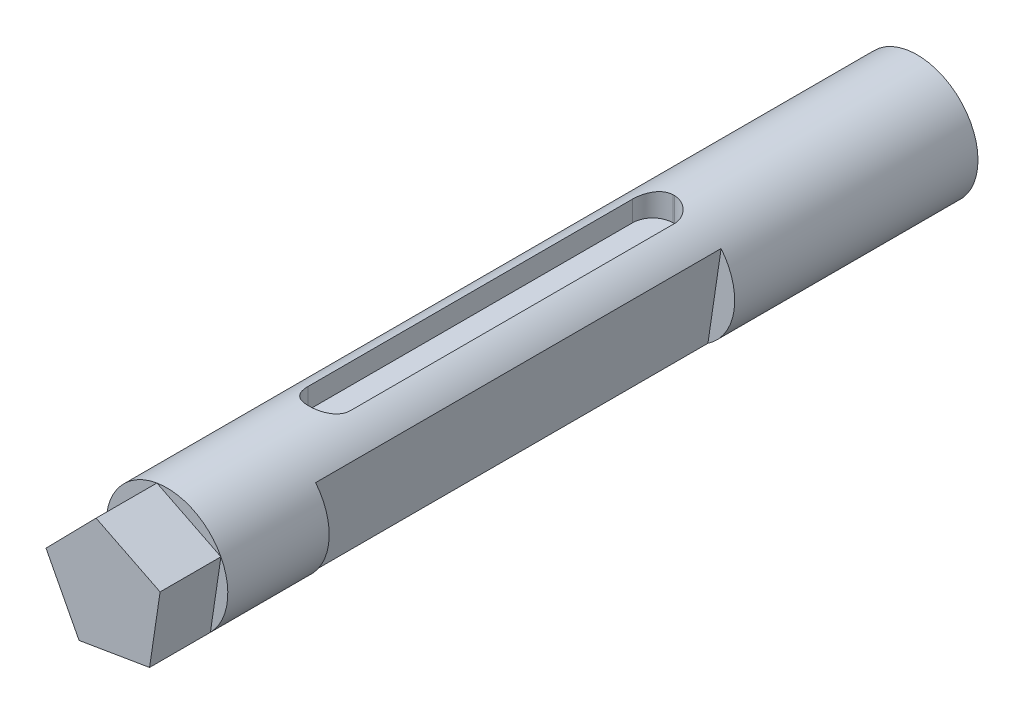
SolidWorks part; units mm, degrees
ref_plane "Front Plane" through (0, 0, 0) normal (0, 0, 1) x (1, 0, 0)
ref_plane "Top Plane" through (0, 0, 0) normal (0, 1, 0) x (1, 0, 0)
ref_plane "Right Plane" through (0, 0, 0) normal (1, 0, 0) x (0, 0, -1)
sketch "Sketch2" plane through (0, 0, 0) normal (0, 0, 1) x (1, 0, 0)
  circle A0 centre (0, 0) radius 19.05
  dimension "D1" = 38.1
extrude "Boss-Extrude1" add sketch "Sketch2" along normal blind 254
sketch "Sketch3" plane through (0, 0, 254) normal (0, 0, 1) x (1, 0, 0)
  line L1 (13.5955, -13.3441) -> (16.8922, 8.8066)
  line L2 (16.8922, 8.8066) -> (-3.1556, 18.7868)
  line L3 (-3.1556, 18.7868) -> (-18.8425, 2.8043)
  line L4 (-18.8425, 2.8043) -> (-8.4897, -17.0537)
  line L5 (-8.4897, -17.0537) -> (13.5955, -13.3441)
  line L6 (-32.0734, 26.7428) -> (32.0734, 26.7428)
  line L7 (-32.0734, 26.7428) -> (-32.0734, -26.7428)
  line L8 (-32.0734, -26.7428) -> (32.0734, -26.7428)
  line L9 (32.0734, 26.7428) -> (32.0734, -26.7428)
  line L10 (-32.0734, 26.7428) -> (32.0734, -26.7428) construction
  line L11 (-32.0734, -26.7428) -> (32.0734, 26.7428) construction
  circle A0 centre (0, 0) radius 15.4118 construction
extrude "Cut-Extrude2" cut sketch "Sketch3" against normal blind 19.05
ref_plane "Plane1" through (0, 19.05, 0) normal (0, 1, 0) x (1, 0, 0)
sketch "Sketch4" plane through (0, 19.05, 0) normal (0, 1, 0) x (1, 0, 0)
  line L0 (16.8922, -254) -> (-3.1556, -254) construction
  line L1 (0.2488, -76.2) -> (-0.2592, -76.2)
  line L2 (6.5988, -82.55) -> (6.5988, -184.15)
  line L3 (0.2488, -190.5) -> (-0.2592, -190.5)
  line L4 (-6.6092, -82.55) -> (-6.6092, -184.15)
  line L5 (6.5988, -76.2) -> (-6.6092, -190.5) construction
  line L6 (6.5988, -190.5) -> (-6.6092, -76.2) construction
  arc A0 (6.5988, -184.15) -> (0.2488, -190.5) centre (0.2488, -184.15) cw
  arc A1 (-0.2592, -190.5) -> (-6.6092, -184.15) centre (-0.2592, -184.15) cw
  arc A2 (-6.6092, -82.55) -> (-0.2592, -76.2) centre (-0.2592, -82.55) cw
  arc A3 (6.5988, -82.55) -> (0.2488, -76.2) centre (0.2488, -82.55) ccw
  point P0 (-0.0052, -133.35)
  dimension "D4" = 6.35
  dimension "D1" = 13.208
  dimension "D2" = 114.3
  dimension "D3" = 63.5
extrude "Cut-Extrude3" cut sketch "Sketch4" against normal blind 7.62
sketch "Sketch5" plane through (0, 0, 0) normal (0, 0, -1) x (-1, 0, 0)
  line L0 (0, 0) -> (0, -44.6971) construction
  line L1 (0, -44.6971) -> (-22.5951, 17.3823) construction
  dimension "D1" = 20
sketch "Sketch6" plane through (15.2439, -2.2687, 0) normal (0.9891, -0.1472, 0) x (0, 0, -1)
  line L0 (-254, -11.1973) -> (-254, 11.1973) construction
  line L1 (-76.2, 30.7933) -> (-203.2, 30.7933)
  line L2 (-76.2, 30.7933) -> (-76.2, -26.889)
  line L3 (-76.2, -26.889) -> (-203.2, -26.889)
  line L4 (-203.2, 30.7933) -> (-203.2, -26.889)
  line L5 (-76.2, 30.7933) -> (-203.2, -26.889) construction
  line L6 (-76.2, -26.889) -> (-203.2, 30.7933) construction
  point P0 (-139.7, 1.9521)
  dimension "D1" = 50.8
  dimension "D2" = 127
extrude "Cut-Extrude4" cut sketch "Sketch6" against normal blind 2.54 and the other way blind 7.62
